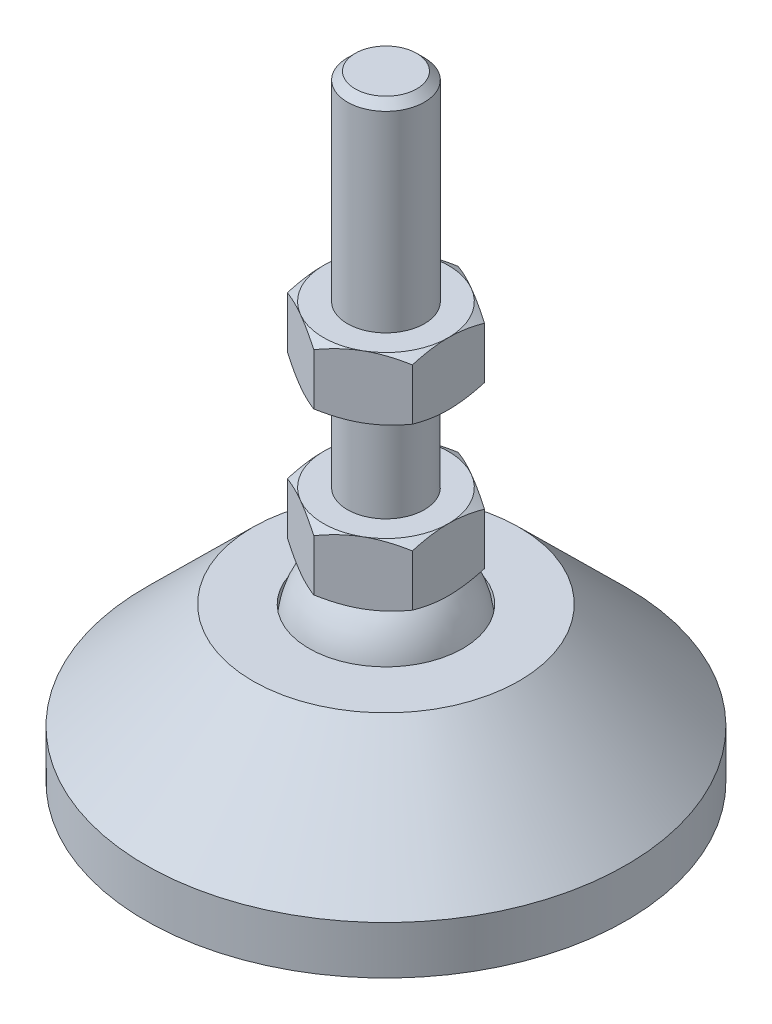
SolidWorks part; units mm, degrees
ref_plane "Plan de face" through (0, 0, 0) normal (0, 0, 1) x (1, 0, 0)
ref_plane "Plan de dessus" through (0, 0, 0) normal (0, 1, 0) x (1, 0, 0)
ref_plane "Plan de droite" through (0, 0, 0) normal (1, 0, 0) x (0, 0, -1)
ref_plane "Plan4" through (0, 0, 0) normal (0, 0, 1) x (1, 0, 0)
sketch "Esquisse1" plane through (0, 0, 0) normal (0, 0, 1) x (1, 0, 0)
  line L0 (7.9975, 16) -> (13.85, 16)
  line L1 (13.85, 16) -> (25, 5)
  line L9 (25, 5) -> (25, 0)
  line L10 (25, 0) -> (0, 0)
  line L11 (0, 0) -> (0, 7.8)
  line L12 (0, 0) -> (0, 7.8) construction
  line L13 (0, 0) -> (0, 24.8525) construction
  arc A0 (0, 7.8) -> (7.9975, 16) centre (0, 15.8) ccw
  dimension "D4" = 8
  dimension "D1" = 50
  dimension "D2" = 5
  dimension "D3" = 16
revolve "Révolution1" add sketch "Esquisse1" angle 360 about L12
ref_plane "Plan5" through (0, 0, 0) normal (0, 0, 1) x (1, 0, 0)
sketch "Esquisse2" plane through (0, 0, 0) normal (0, 0, 1) x (1, 0, 0)
  line L0 (0, 64) -> (3.2, 64)
  line L1 (3.2, 64) -> (4, 63.2)
  line L2 (4, 63.2) -> (4, 21.1182)
  line L3 (-25, 0) -> (25, 0) construction
  line L8 (0, 6.19) -> (0, 64)
  line L9 (0, 6.19) -> (0, 64) construction
  arc A0 (4, 21.1182) -> (0, 6.19) centre (0, 14.19) cw
  dimension "D5" = 8
  dimension "D1" = 4
  dimension "D2" = 0.8
  dimension "D3" = 45
  dimension "D4" = 64
revolve "Révolution2" add sketch "Esquisse2" angle 360 about L9
ref_plane "Plan6" through (0, 0, 0) normal (0, 0, 1) x (1, 0, 0)
ref_plane "Plan7" through (0, 36.75, 0) normal (0, -1, 0) x (1, 0, 0)
inserted part "ECROU H M8"
move or copy body "Corps-Déplacer/Copier2" placed by mates yes
other "<ECROU H M8>-<Enlèv. mat.-Extru.1>"
inserted part "ECROU H M83"
move or copy body "Corps-Déplacer/Copier4" placed by mates yes
other "Distance3" parameters "D1"=20
other "<ECROU H M8>-<Enlèv. mat.-Extru.1>"
